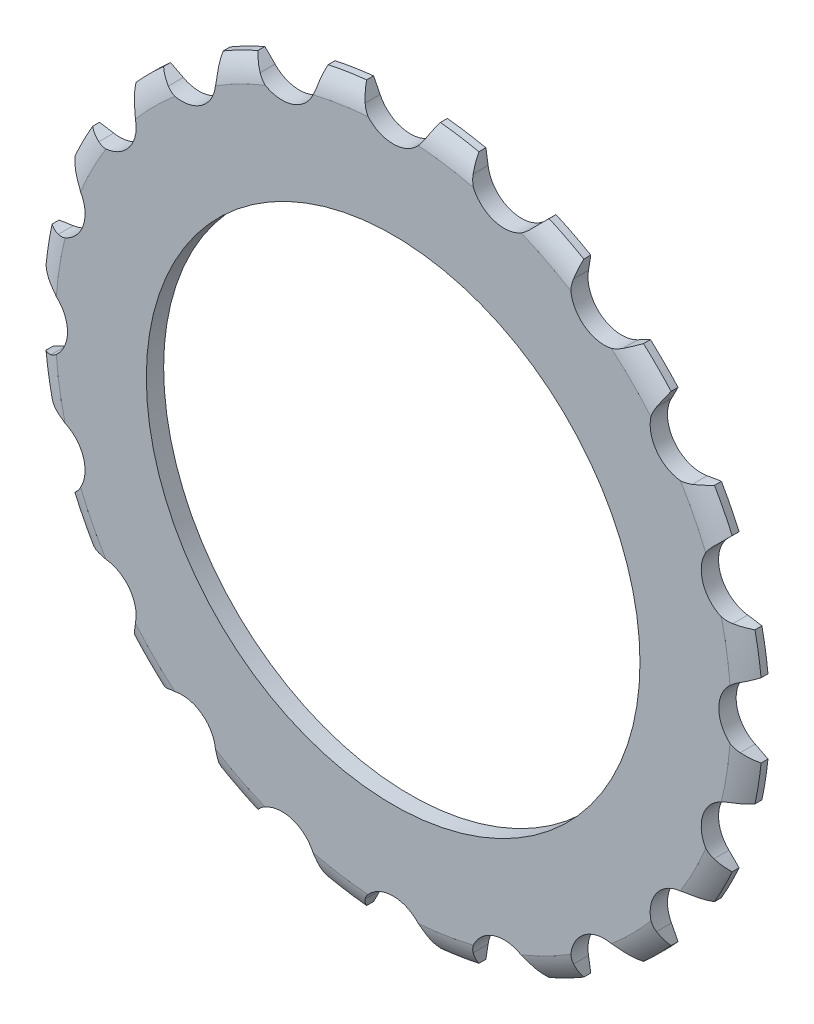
SolidWorks part; units mm, degrees
ref_plane "Front" through (0, 0, 0) normal (0, 0, 1) x (1, 0, 0)
ref_plane "Top" through (0, 0, 0) normal (0, 1, 0) x (1, 0, 0)
ref_plane "Right" through (0, 0, 0) normal (1, 0, 0) x (0, 0, -1)
sketch "Sketch1" plane through (0, 0, 0) normal (0, 0, 1) x (1, 0, 0)
  line L0 (0, 37.6) -> (0, 0) construction
  line L1 (0, 37.6) -> (0, 41.5) construction
  line L2 (0, 41.5) -> (0, 44.35) construction
  circle A0 centre (0, 0) radius 37.6 construction
  circle A3 centre (0, 0) radius 41.5 construction
  arc A4 (-5.7825, 43.9714) -> (-3.5084, 39.7967) centre (-49.2074, 17.6101) cw
  arc A5 (5.7825, 43.9714) -> (3.5084, 39.7967) centre (49.2074, 17.6101) ccw
  arc A6 (-3.5084, 39.7967) -> (3.5084, 39.7967) centre (0, 41.5) ccw
  arc A10 (5.7825, 43.9714) -> (-5.7825, 43.9714) centre (0, 0) ccw
  point P4 (6.3314, 41.0142)
  dimension "D1" = 2.85
  dimension "D2" = 3.9
  dimension "D3" = 50.8
  dimension "D5" = 11.5649
  dimension "D6" = 83
  dimension "D4" = 6.35
sketch "Sketch2" plane through (0, 0, 0) normal (1, 0, 0) x (0, 0, -1)
  line L0 (-1.2, 28.5) -> (0.8, 28.5)
  line L1 (0, 41.5) -> (0, -41.5) construction
  line L5 (-1.2, 28.5) -> (-1.2, 39)
  line L7 (0, 41.5) -> (0.8, 41.5)
  line L8 (0.8, 28.5) -> (0.8, 41.5)
  arc A0 (-1.2, 39) -> (0, 41.5) centre (4.1982, 37.9469) cw
  dimension "D4" = 2
  dimension "D7" = 5.5
  dimension "D1" = 28.5
  dimension "D5" = 2.5
  dimension "D6" = 0.8
ref_axis "Axis1" through (0, 0, -80.9) along (0, 0, 1)
revolve "Revolve1" add sketch "Sketch2" angle 360 about axis through (0, 0, -80.9) along (0, 0, 1)
extrude "Extrude1" cut sketch "Sketch1" against normal through all and the other way through all
pattern_circular "CirPattern1" count 20 over 360 about axis through (0, 0, 0) along (0, 0, 1) of "Extrude1"
